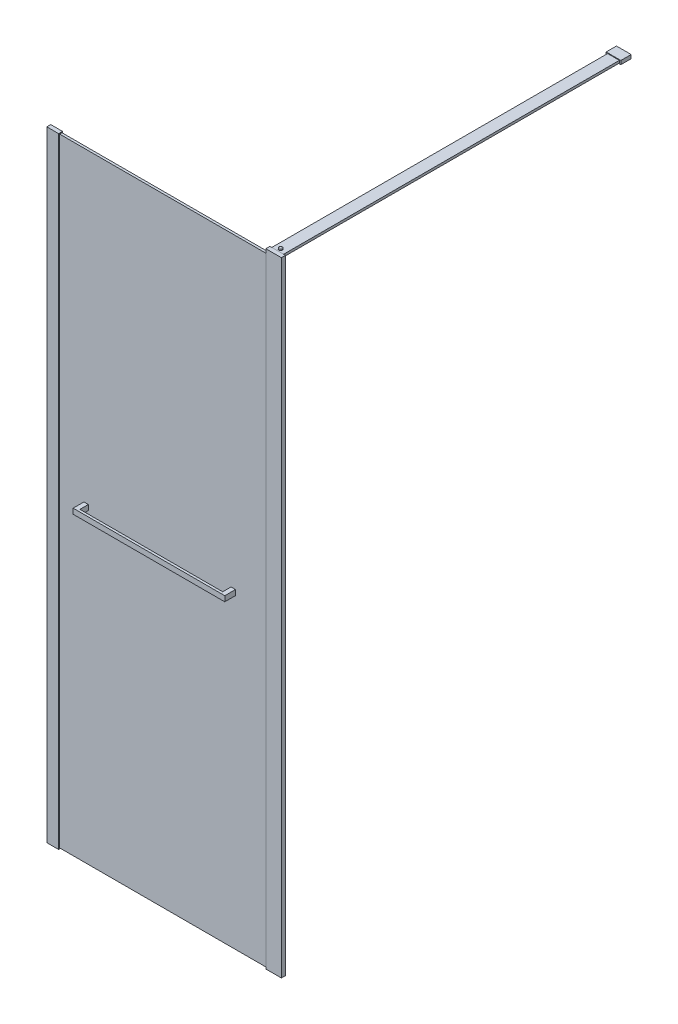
SolidWorks part; units mm, degrees
ref_plane "Płaszczyzna przednia" through (0, 0, 0) normal (0, 0, 1) x (1, 0, 0)
ref_plane "Płaszczyzna górna" through (0, 0, 0) normal (0, 1, 0) x (1, 0, 0)
ref_plane "Płaszczyzna prawa" through (0, 0, 0) normal (1, 0, 0) x (0, 0, -1)
sketch "Szkic1" plane through (0, 0, 0) normal (0, 1, 0) x (1, 0, 0)
  line L0 (0, 0) -> (0, 13.3)
  line L1 (0, 13.3) -> (40, 13.3)
  line L2 (40, 13.3) -> (40, 11.4)
  line L3 (40, 11.4) -> (6.5, 11.4)
  line L4 (6.5, 11.4) -> (6.5, 3.4)
  line L5 (6.5, 3.4) -> (40, 3.4)
  line L6 (40, 3.4) -> (40, 0)
  line L7 (40, 0) -> (0, 0)
  dimension "D1" = 40
  dimension "D2" = 13.3
  dimension "D3" = 33.5
  dimension "D4" = 1.9
  dimension "D5" = 8
extrude "Dodanie-wyciągnięcie1" add sketch "Szkic1" along normal blind 2100 from offset 3
sketch "Szkic2" plane through (0, 3, 0) normal (0, -1, 0) x (1, 0, 0)
  line L0 (6.5, -11.4) -> (40, -11.4) construction
  line L1 (6.5, -3.4) -> (753.5, -3.4)
  line L2 (6.5, -3.4) -> (6.5, -11.4)
  line L3 (6.5, -11.4) -> (753.5, -11.4)
  line L4 (753.5, -3.4) -> (753.5, -11.4)
  dimension "D1" = 747
extrude "Dodanie-wyciągnięcie2" add sketch "Szkic2" against normal blind 2100 separate body
sketch "Szkic3" plane through (0, 3, 0) normal (0, -1, 0) x (1, 0, 0)
  line L0 (743.4, -3.4) -> (743.4, -0.4)
  line L1 (753.5, -3.4) -> (6.5, -3.4) construction
  line L2 (743.4, -0.4) -> (796.4, -0.4)
  line L3 (796.4, -0.4) -> (796.4, -14.4)
  line L4 (796.4, -14.4) -> (743.4, -14.4)
  line L5 (743.4, -14.4) -> (743.4, -11.4)
  line L6 (743.4, -11.4) -> (753.5, -11.4)
  line L7 (753.5, -11.4) -> (753.5, -3.4)
  line L8 (753.5, -3.4) -> (743.4, -3.4)
  line L9 (6.5, -11.4) -> (753.5, -11.4) construction
  line L10 (753.5, -11.4) -> (753.5, -3.4) construction
  dimension "D1" = 10.1
  dimension "D2" = 3
  dimension "D3" = 3
  dimension "D4" = 53
extrude "Dodanie-wyciągnięcie3" add sketch "Szkic3" against normal blind 2108 separate body
sketch "Szkic4" plane through (0, 2103, 0) normal (0, 1, 0) x (1, 0, 0)
  line L1 (0, 13.3) -> (40, 13.3)
  line L2 (0, 13.3) -> (0, 0)
  line L3 (0, 0) -> (40, 0)
  line L4 (40, 13.3) -> (40, 0)
extrude "Dodanie-wyciągnięcie4" add sketch "Szkic4" along normal blind 3
sketch "Szkic5" plane through (0, 2111, 0) normal (0, 1, 0) x (1, 0, 0)
  line L1 (796.4, 14.4) -> (743.4, 14.4)
  line L2 (796.4, 14.4) -> (796.4, 0.4)
  line L3 (796.4, 0.4) -> (743.4, 0.4)
  line L4 (743.4, 14.4) -> (743.4, 0.4)
extrude "Dodanie-wyciągnięcie5" add sketch "Szkic5" along normal blind 8
sketch "Szkic6" plane through (743.4, 0, 0) normal (-1, 0, 0) x (0, 0, 1)
  line L0 (-11.4, 2111) -> (-3.4, 2111) construction
  line L1 (-3.35, 2111) -> (-11.45, 2111)
  line L2 (-3.35, 2111) -> (-3.35, 2103.2)
  line L3 (-3.35, 2103.2) -> (-11.45, 2103.2)
  line L4 (-11.45, 2111) -> (-11.45, 2103.2)
  point P6 (-7.4, 2111)
  dimension "D1" = 8.1
  dimension "D2" = 7.8
extrude "Dodanie-wyciągnięcie6" add sketch "Szkic6" against normal blind 15 from offset 1.3
sketch "Szkic7" plane through (0, 3, 0) normal (0, -1, 0) x (1, 0, 0)
  line L1 (743.4, -0.4) -> (796.4, -0.4)
  line L2 (743.4, -0.4) -> (743.4, -14.4)
  line L3 (743.4, -14.4) -> (796.4, -14.4)
  line L4 (796.4, -0.4) -> (796.4, -14.4)
extrude "Dodanie-wyciągnięcie7" add sketch "Szkic7" along normal blind 3
sketch "Szkic8" plane through (0, 3, 0) normal (0, -1, 0) x (1, 0, 0)
  line L1 (0, 0) -> (40, 0)
  line L2 (0, 0) -> (0, -13.3)
  line L3 (0, -13.3) -> (40, -13.3)
  line L4 (40, 0) -> (40, -13.3)
extrude "Dodanie-wyciągnięcie8" add sketch "Szkic8" along normal blind 3
sketch "Szkic9" plane through (0, 0, -14.4) normal (0, 0, -1) x (-1, 0, 0)
  line L0 (-796.4, 2119) -> (-743.4, 2119) construction
  line L1 (-789.9, 2119) -> (-749.9, 2119)
  line L2 (-789.9, 2119) -> (-789.9, 2111)
  line L3 (-789.9, 2111) -> (-749.9, 2111)
  line L4 (-749.9, 2119) -> (-749.9, 2111)
  line L5 (-796.4, 2119) -> (-796.4, 0) construction
  line L6 (-743.4, 2119) -> (-743.4, 0) construction
  dimension "D1" = 6.5
  dimension "D2" = 6.5
  dimension "D3" = 8
extrude "Dodanie-wyciągnięcie9" add sketch "Szkic9" along normal blind 1170 separate body
sketch "Szkic10" plane through (0, 0, -1184.4) normal (0, 0, -1) x (-1, 0, 0)
  line L0 (-769.9, 2119) -> (-769.9, 2115) construction
  line L1 (-794.9, 2121.25) -> (-744.9, 2121.25)
  line L2 (-794.9, 2121.25) -> (-794.9, 2108.75)
  line L3 (-794.9, 2108.75) -> (-744.9, 2108.75)
  line L4 (-744.9, 2121.25) -> (-744.9, 2108.75)
  line L5 (-794.9, 2121.25) -> (-744.9, 2108.75) construction
  line L6 (-794.9, 2108.75) -> (-744.9, 2121.25) construction
  line L7 (-749.9, 2119) -> (-789.9, 2119) construction
  line L8 (-769.9, 2115) -> (-789.9, 2115) construction
  line L9 (-789.9, 2119) -> (-789.9, 2111) construction
  point P0 (-769.9, 2115)
  dimension "D1" = 12.5
  dimension "D2" = 50
extrude "Dodanie-wyciągnięcie10" add sketch "Szkic10" along normal blind 35 from offset 29.4
ref_plane "Płaszczyzna1" through (769.9, 0, 0) normal (1, 0, 0) x (0, 0, -1)
sketch "Szkic11" plane through (769.9, 0, 0) normal (1, 0, 0) x (0, 0, -1)
  line L0 (24.4, 2119) -> (24.4, 2127.4416) construction
  line L1 (24.4, 2119) -> (34.6926, 2119) construction
  line L2 (30.3, 2119) -> (30.05, 2122.8)
  line L3 (24.4, 2124.7) -> (30.2413, 2124.7) construction
  line L4 (24.4, 2124.7) -> (24.4, 2124.2)
  line L5 (1155, 2119) -> (14.4, 2119) construction
  line L6 (14.4, 2119) -> (14.4, 2111) construction
  line L7 (29.7989, 2119) -> (30.3, 2119)
  line L9 (29.5663, 2122.5357) -> (29.7989, 2119)
  arc A0 (24.4, 2124.7) -> (30.05, 2122.8) centre (24.4, 2115.3493) cw
  arc A1 (29.5663, 2122.5357) -> (24.4, 2124.2) centre (24.4, 2115.3493) ccw
  dimension "D1" = 0.5
  dimension "D2" = 11.3
  dimension "D3" = 5.7
  dimension "D4" = 3.8
  dimension "D5" = 11.8
  dimension "D6" = 0.5
  dimension "D7" = 10
revolve "Obrót1" add sketch "Szkic11" angle 360 about L0
sketch "Szkic12" plane through (0, 0, -3.4) normal (0, 0, 1) x (1, 0, 0)
  line L0 (380, 1409.7928) -> (380, 762.3594) construction
  line L1 (130, 1053) -> (630, 1053) construction
  line L2 (6.5, 2103) -> (6.5, 3) construction
  line L3 (753.5, 2103) -> (753.5, 3) construction
  line L5 (122.5, 1062) -> (137.5, 1062)
  line L6 (122.5, 1062) -> (122.5, 1044)
  line L7 (122.5, 1044) -> (137.5, 1044)
  line L8 (137.5, 1062) -> (137.5, 1044)
  line L9 (122.5, 1062) -> (137.5, 1044) construction
  line L10 (122.5, 1044) -> (137.5, 1062) construction
  line L11 (622.5, 1062) -> (637.5, 1062)
  line L12 (622.5, 1062) -> (622.5, 1044)
  line L13 (622.5, 1044) -> (637.5, 1044)
  line L14 (637.5, 1062) -> (637.5, 1044)
  line L15 (622.5, 1062) -> (637.5, 1044) construction
  line L16 (622.5, 1044) -> (637.5, 1062) construction
  dimension "D1" = 1053
  dimension "D2" = 500
  dimension "D3" = 15
  dimension "D4" = 18
extrude "Dodanie-wyciągnięcie11" add sketch "Szkic12" along normal blind 36.5 and the other way blind 18 separate body
sketch "Szkic13" plane through (137.5, 0, 0) normal (1, 0, 0) x (0, 0, -1)
  line L0 (21.4, 1044) -> (-33.1, 1044) construction
  line L1 (-33.1, 1062) -> (-25.1, 1062)
  line L2 (-33.1, 1062) -> (-33.1, 1044)
  line L3 (-33.1, 1044) -> (-25.1, 1044)
  line L4 (-25.1, 1062) -> (-25.1, 1044)
  dimension "D1" = 8
extrude "Dodanie-wyciągnięcie12" add sketch "Szkic13" along normal up to surface (485 mm away)
